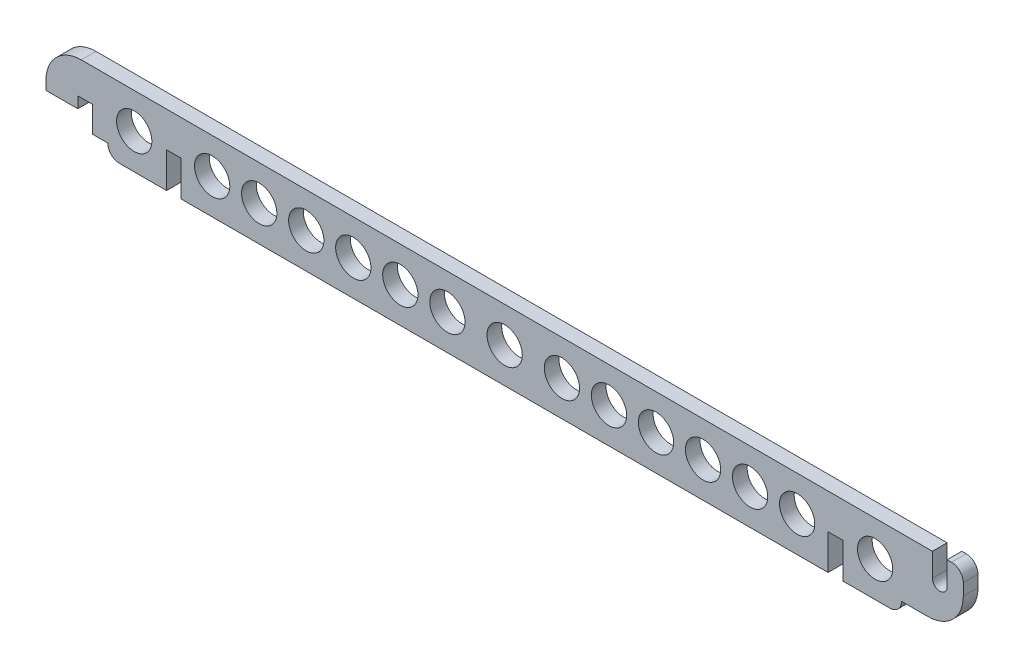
SolidWorks part; units mm, degrees
ref_plane "Front Plane" through (0, 0, 0) normal (0, 0, 1) x (1, 0, 0)
ref_plane "Top Plane" through (0, 0, 0) normal (0, 1, 0) x (1, 0, 0)
ref_plane "Right Plane" through (0, 0, 0) normal (1, 0, 0) x (0, 0, -1)
sketch "Sketch1" plane through (0, 0, 0) normal (0, 0, 1) x (1, 0, 0)
  line L0 (13.4741, 28.8186) -> (13.4741, 31.3586)
  line L1 (-184.6459, 24.3736) -> (-184.6459, 26.2786)
  line L2 (10.9341, 33.8986) -> (9.9816, 33.8986)
  line L3 (-15.7359, 18.6586) -> (-155.4359, 18.6586)
  line L4 (-158.6109, 18.6586) -> (-168.7709, 18.6586)
  line L5 (-177.7879, 24.3736) -> (-184.6459, 24.3736)
  line L6 (-171.3109, 21.1986) -> (-174.6129, 21.1986)
  line L7 (-155.4359, 26.2786) -> (-158.6109, 26.2786)
  line L8 (-85.5859, 33.8986) -> (-85.5859, -11.9097) construction
  line L9 (-158.6109, 26.2786) -> (-158.6109, 18.6586)
  line L10 (-155.4359, 26.2786) -> (-155.4359, 18.6586)
  line L11 (-174.6129, 26.7991) -> (-174.6129, 21.1986)
  line L12 (-177.7879, 24.3736) -> (-177.7879, 26.7991)
  line L13 (-177.7879, 26.7991) -> (-174.6129, 26.7991)
  line L16 (6.8066, 33.8986) -> (6.8066, 28.8186)
  line L17 (6.8066, 33.8986) -> (-177.0259, 33.8986)
  line L18 (9.9816, 33.8986) -> (9.9816, 28.8186)
  line L20 (-15.7359, 26.2786) -> (-15.7359, 18.6586)
  line L21 (-12.5609, 26.2786) -> (-12.5609, 18.6586)
  line L22 (-15.7359, 26.2786) -> (-12.5609, 26.2786)
  line L23 (0.1391, 21.1986) -> (5.8541, 21.1986)
  line L25 (-12.5609, 18.6586) -> (-2.4009, 18.6586)
  circle A0 centre (-165.5957, 26.2786) radius 3.81
  arc A1 (-171.3109, 21.1986) -> (-168.7709, 18.6586) centre (-168.7709, 21.1986) ccw
  arc A2 (-177.0259, 33.8986) -> (-184.6459, 26.2786) centre (-177.0259, 26.2786) ccw
  circle A3 centre (-148.7571, 26.2786) radius 3.81
  circle A4 centre (-138.5971, 26.2786) radius 3.81
  circle A5 centre (-128.4371, 26.2786) radius 3.81
  circle A6 centre (-118.2771, 26.2786) radius 3.81
  circle A7 centre (-108.1171, 26.2786) radius 3.81
  circle A8 centre (-97.9571, 26.2786) radius 3.81
  circle A9 centre (-73.2146, 26.2786) radius 3.81
  circle A10 centre (-63.0546, 26.2786) radius 3.81
  circle A11 centre (-52.8946, 26.2786) radius 3.81
  circle A12 centre (-42.7346, 26.2786) radius 3.81
  circle A13 centre (-32.5746, 26.2786) radius 3.81
  circle A14 centre (-22.4146, 26.2786) radius 3.81
  arc A15 (6.8066, 28.8186) -> (9.9816, 28.8186) centre (8.3941, 28.8186) ccw
  arc A16 (0.1391, 21.1986) -> (-2.4009, 18.6586) centre (-2.4009, 21.1986) cw
  circle A17 centre (-5.576, 26.2786) radius 3.81
  circle A18 centre (-85.5859, 26.2786) radius 3.81
  arc A19 (5.8541, 21.1986) -> (13.4741, 28.8186) centre (5.8541, 28.8186) ccw
  arc A20 (10.9341, 33.8986) -> (13.4741, 31.3586) centre (10.9341, 31.3586) cw
  point P33 (-85.5859, 18.6586)
  point P66 (-85.5859, 18.6586)
  dimension "D1" = 2.54
  dimension "D2" = 7.62
  dimension "D4" = 2.54
  dimension "D3" = 15.24
extrude "Boss-Extrude1" add sketch "Sketch1" along normal blind 3.175
